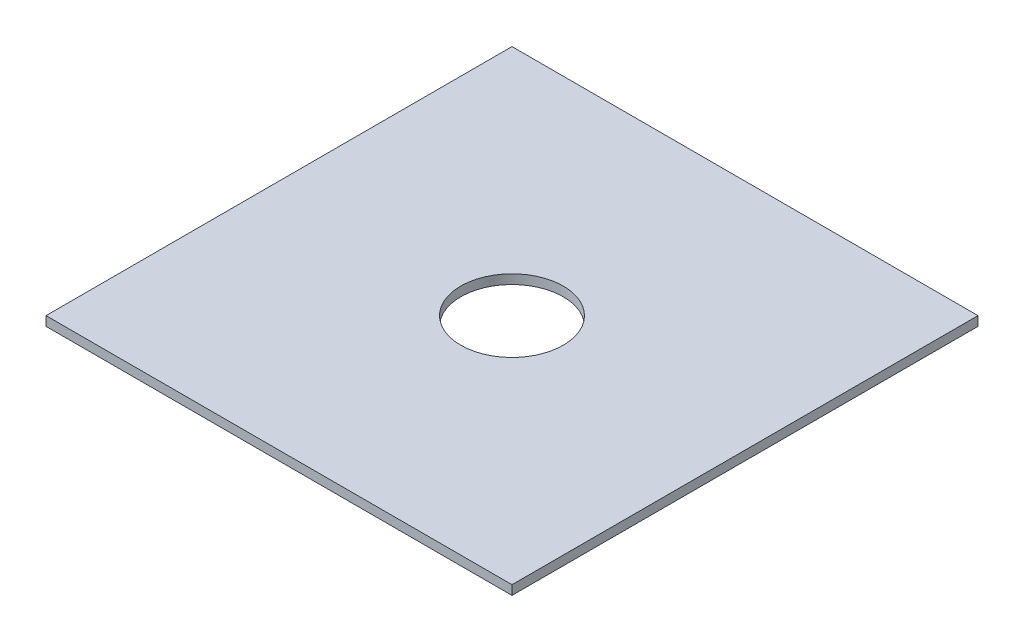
SolidWorks part; units mm, degrees
ref_plane "Front Plane" through (0, 0, 0) normal (0, 0, 1) x (1, 0, 0)
ref_plane "Top Plane" through (0, 0, 0) normal (0, 1, 0) x (1, 0, 0)
ref_plane "Right Plane" through (0, 0, 0) normal (1, 0, 0) x (0, 0, -1)
sketch "Sketch1" plane through (0, 0, 0) normal (0, 1, 0) x (1, 0, 0)
  line L1 (-50, -50) -> (50, -50)
  line L2 (-50, -50) -> (-50, 50)
  line L3 (-50, 50) -> (50, 50)
  line L4 (50, -50) -> (50, 50)
  line L5 (-50, -50) -> (50, 50) construction
  line L6 (-50, 50) -> (50, -50) construction
  circle A1 centre (0, 0) radius 11
  point P0 (0, 0)
  point P23 (0, 0)
  dimension "D4" = 22
  dimension "D1" = 100
  dimension "D2" = 100
extrude "Boss-Extrude1" add sketch "Sketch1" along normal blind 2
